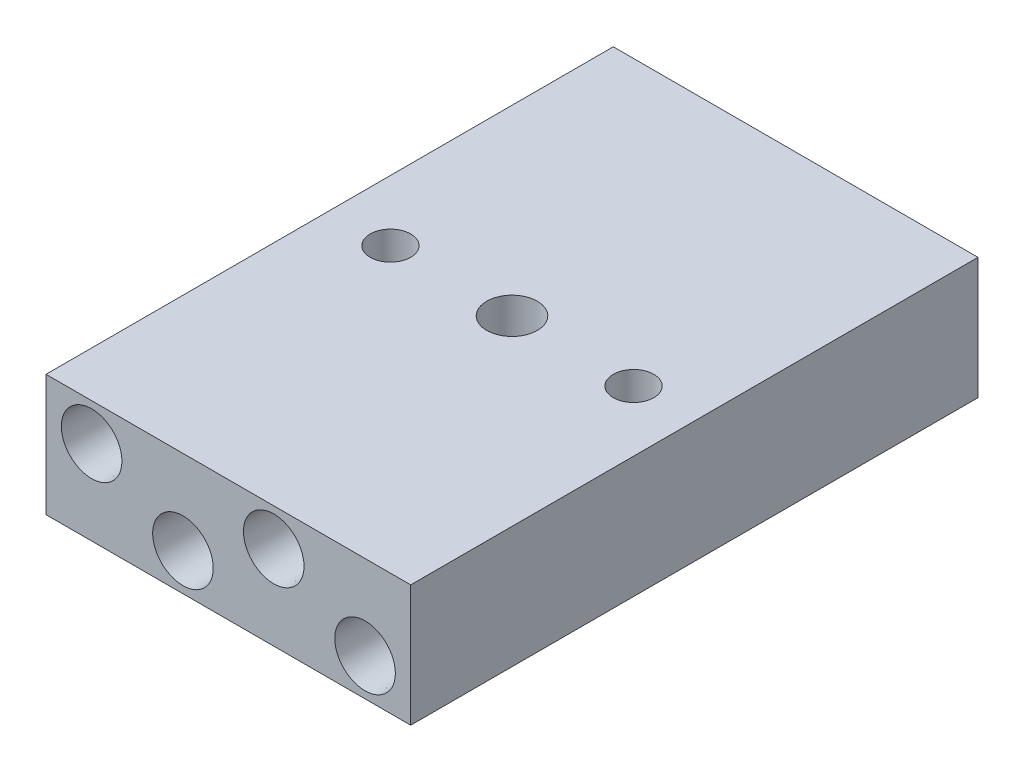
SolidWorks part; units mm, degrees
ref_plane "Front" through (0, 0, 0) normal (0, 0, 1) x (1, 0, 0)
ref_plane "Top" through (0, 0, 0) normal (0, 1, 0) x (1, 0, 0)
ref_plane "Right" through (0, 0, 0) normal (1, 0, 0) x (0, 0, -1)
sketch "Sketch1" plane through (0, 0, 0) normal (0, 0, 1) x (1, 0, 0)
  line L0 (0, 0) -> (0, 9.525) construction
  line L1 (-28.575, 9.525) -> (28.575, 9.525)
  line L2 (-28.575, 9.525) -> (-28.575, -9.525)
  line L3 (-28.575, -9.525) -> (28.575, -9.525)
  line L4 (28.575, 9.525) -> (28.575, -9.525)
  line L5 (0, 0) -> (28.575, 0) construction
  dimension "D1" = 57.15
  dimension "D2" = 19.05
extrude "Extrude1" add sketch "Sketch1" against normal blind 88.9
hole_wizard "1/8 NPT Tapped Hole1" positions "3DSketch1" profile "Sketch2" size "1/8" standard "Ansi Inch"
sketch3d "3DSketch1"
  line L0 (0, 0, 0) -> (0, 9.525, 0) construction
  line L1 (0, 0, 0) -> (28.575, 0, 0) construction
  line L2 (28.575, 9.525, 0) -> (-28.575, 9.525, 0) construction
  line L3 (28.575, -9.525, 0) -> (28.575, 9.525, 0) construction
  line L4 (-28.575, -9.525, 0) -> (28.575, -9.525, 0) construction
  point P0 (-21.4249, 3.683, 0)
  point P1 (-7.112, -3.683, 0)
  point P2 (7.112, 3.683, 0)
  point P3 (21.4249, -3.683, 0)
  dimension "D1" = 7.112
  dimension "D2" = 7.112
  dimension "D3" = 21.4249
  dimension "D4" = 21.4249
  dimension "D5" = 5.842
  dimension "D6" = 5.842
sketch "Sketch2" plane through (-21.4249, 3.683, 0) normal (1, 0, 0) x (0, -1, 0)
  line L0 (0, 0) -> (0, 14.1565)
  line L1 (4.2164, 11.623) -> (0, 14.1565)
  line L2 (-4.2164, 11.623) -> (0, 14.1565) construction
  line L3 (4.2164, 11.623) -> (4.2164, 6.924)
  line L4 (4.2164, 6.924) -> (4.5374, 6.924)
  line L5 (4.5374, 6.924) -> (4.7447, 0)
  line L6 (-4.5374, 6.924) -> (-4.7447, 0) construction
  line L7 (4.7447, 0) -> (0, 0)
  line L8 (0, -6.35) -> (0, 107.95) construction
  line L11 (-4.2164, 6.924) -> (-4.5374, 6.924) construction
  dimension "Tap Drill Dia." = 8.4328
  dimension "Tap Drill Depth" = 11.623
  dimension "Thread Dia." = 9.4894
  dimension "Thread Angle" = 3.43
  dimension "Thread Depth" = 6.924
  dimension "Drill Angle" = 118
sketch "Sketch3" plane through (0, -9.525, 0) normal (0, -1, 0) x (1, 0, 0)
  line L0 (0, 0) -> (0, -88.9) construction
  line L1 (-28.575, -88.9) -> (28.575, -88.9) construction
  circle A0 centre (0, -44.45) radius 3.9688
  dimension "D1" = 7.9375
extrude "Cut-Extrude1" cut sketch "Sketch3" against normal through all
sketch "Sketch4" plane through (0, 9.525, 0) normal (0, 1, 0) x (-1, 0, 0)
  line L0 (28.575, -44.45) -> (-28.575, -44.45) construction
  line L1 (28.575, -88.9) -> (28.575, 0) construction
  line L2 (-28.575, -88.9) -> (-28.575, 0) construction
  line L3 (0, -88.9) -> (0, -44.45) construction
  line L4 (-28.575, -88.9) -> (28.575, -88.9) construction
  circle A0 centre (19.05, -44.45) radius 3.175
  circle A1 centre (-19.05, -44.45) radius 3.175
  dimension "D1" = 6.35
  dimension "D2" = 19.05
extrude "Cut-Extrude2" cut sketch "Sketch4" against normal blind 6.35
